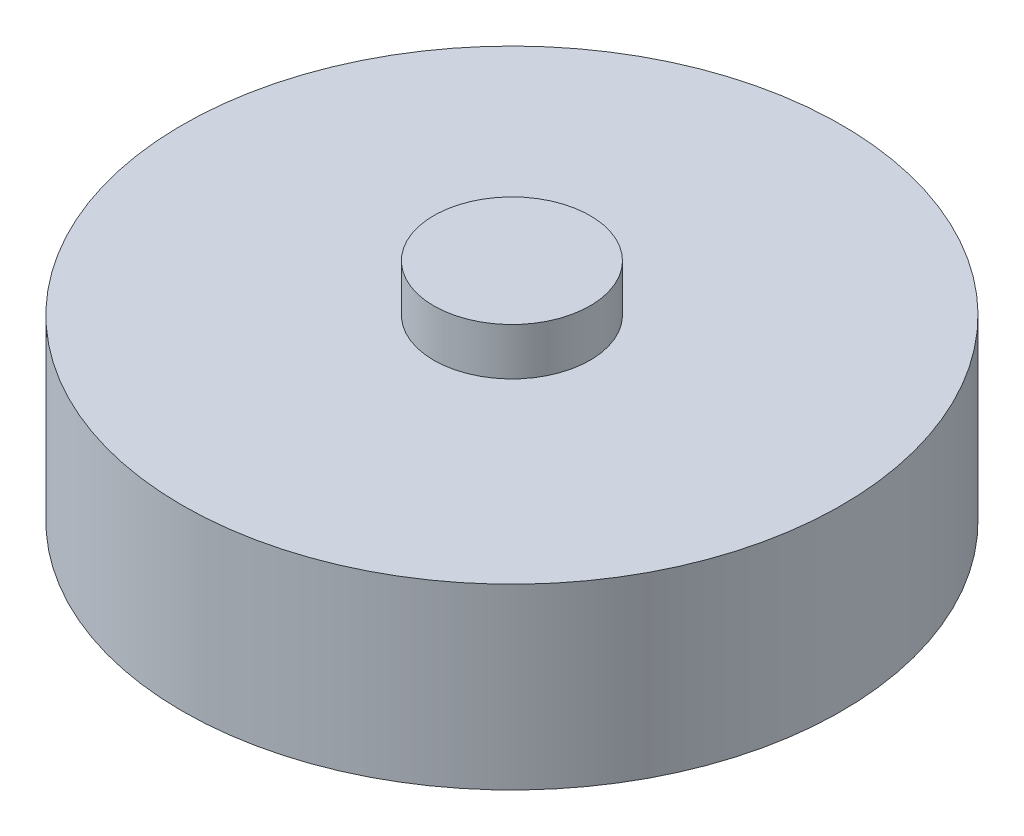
SolidWorks part; units mm, degrees
ref_plane "Front" through (0, 0, 0) normal (0, 0, 1) x (1, 0, 0)
ref_plane "Top" through (0, 0, 0) normal (0, 1, 0) x (1, 0, 0)
ref_plane "Right" through (0, 0, 0) normal (1, 0, 0) x (0, 0, -1)
sketch "Sketch1" plane through (0, 0, 0) normal (0, 1, 0) x (1, 0, 0)
  circle A0 centre (0, 0) radius 4.826
  dimension "D1" = 9.652
extrude "Boss-Extrude1" add sketch "Sketch1" along normal blind 2.61
sketch "Sketch2" plane through (0, 2.61, 0) normal (0, 1, 0) x (1, 0, 0)
  circle A0 centre (0, 0) radius 1.145
  dimension "D1" = 2.29
extrude "Boss-Extrude2" add sketch "Sketch2" along normal blind 0.69
